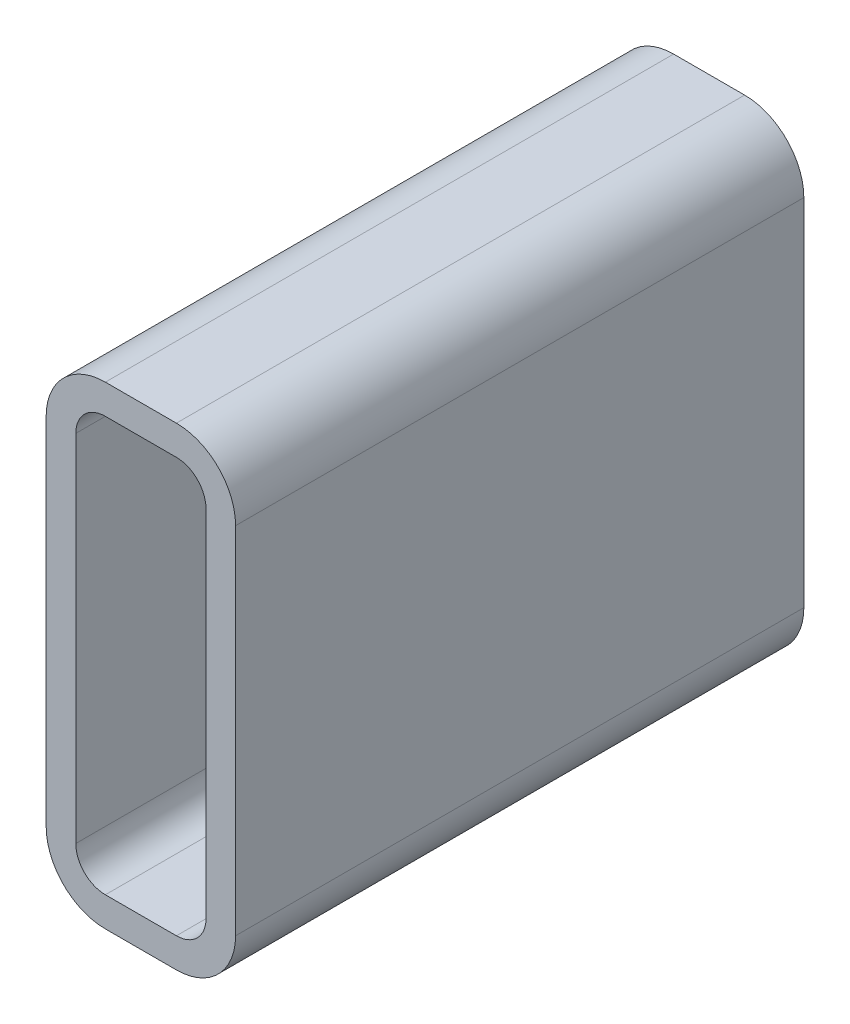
SolidWorks part; units mm, degrees
ref_plane "Front Plane" through (0, 0, 0) normal (0, 0, 1) x (1, 0, 0)
ref_plane "Top Plane" through (0, 0, 0) normal (0, 1, 0) x (1, 0, 0)
ref_plane "Right Plane" through (0, 0, 0) normal (1, 0, 0) x (0, 0, -1)
sketch "Sketch1" plane through (0, 0, 0) normal (0, 0, 1) x (1, 0, 0)
sketch_block_instance "HSS10x4x0.625-1"
sketch_block "HSS10x4x0.625"
extrude "Boss-Extrude1" add sketch "Sketch1" along normal blind 304.8
